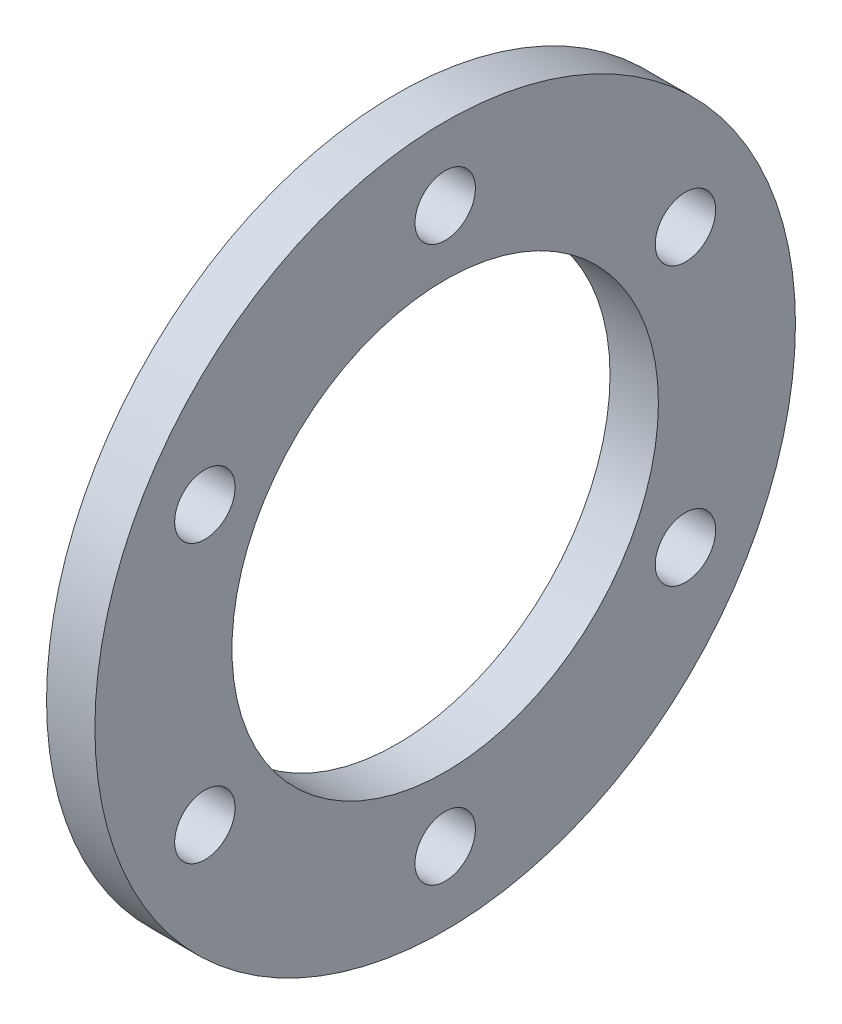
SolidWorks part; units mm, degrees
ref_plane "Front Plane" through (0, 0, 0) normal (0, 0, 1) x (1, 0, 0)
ref_plane "Top Plane" through (0, 0, 0) normal (0, 1, 0) x (1, 0, 0)
ref_plane "Right Plane" through (0, 0, 0) normal (1, 0, 0) x (0, 0, -1)
sketch "Sketch1" plane through (0, 0, 0) normal (1, 0, 0) x (0, 0, -1)
  circle A0 centre (0, 0) radius 28
  circle A1 centre (0, 0) radius 46
  dimension "D1" = 18
  dimension "D2" = 56
extrude "Boss-Extrude1" add sketch "Sketch1" along normal blind 6.35
sketch "Sketch2" plane through (6.35, 0, 0) normal (1, 0, 0) x (0, 0, -1)
  circle A0 centre (0, 0) radius 36.4353 construction
  circle A1 centre (0, 36.4353) radius 3.9688
  dimension "D1" = 72.8706
  dimension "D2" = 7.9375
extrude "Cut-Extrude1" cut sketch "Sketch2" against normal through all
pattern_circular "CirPattern1" count 6 over 360 about axis through (0, 0, 0) along (1, 0, 0) of "Cut-Extrude1"
